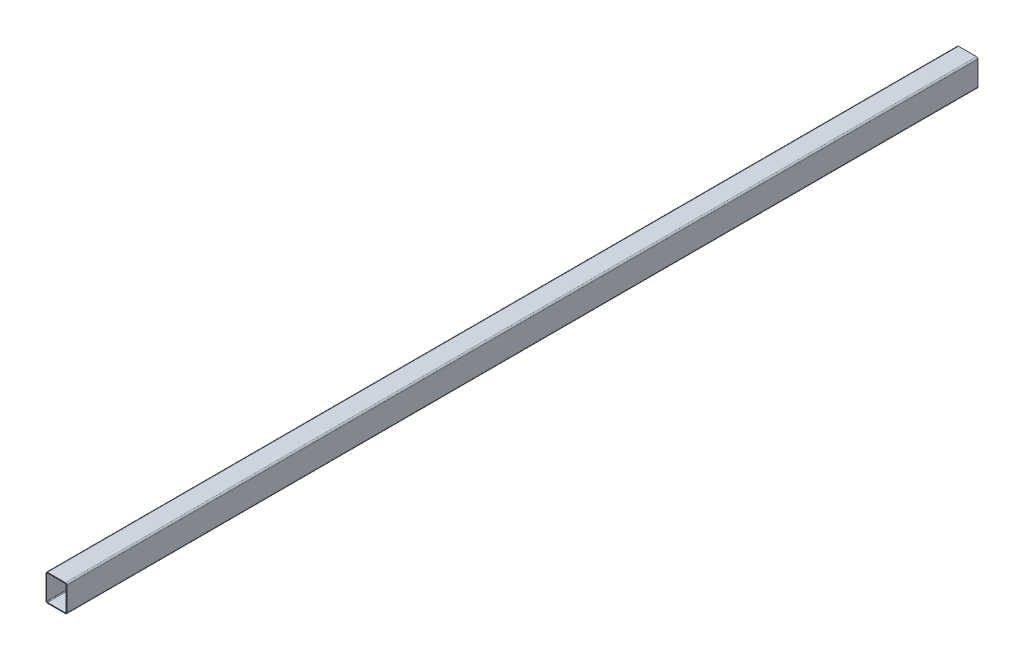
SolidWorks part; units mm, degrees
ref_plane "Front Plane" through (0, 0, 0) normal (0, 0, 1) x (1, 0, 0)
ref_plane "Top Plane" through (0, 0, 0) normal (0, 1, 0) x (1, 0, 0)
ref_plane "Right Plane" through (0, 0, 0) normal (1, 0, 0) x (0, 0, -1)
sketch "Sketch1" plane through (0, 0, 0) normal (0, 0, 1) x (1, 0, 0)
  line B0 (0.5868, 9.0765) -> (6.5868, 9.0765)
  arc B1 (7.0868, 8.5765) -> (6.5868, 9.0765) centre (6.5868, 8.5765) ccw
  line B2 (7.0868, 8.5765) -> (7.0868, 0.5765)
  arc B3 (6.5868, 0.0765) -> (7.0868, 0.5765) centre (6.5868, 0.5765) ccw
  line B4 (6.5868, 0.0765) -> (0.5868, 0.0765)
  arc B5 (0.0868, 0.5765) -> (0.5868, 0.0765) centre (0.5868, 0.5765) ccw
  line B6 (0.0868, 0.5765) -> (0.0868, 8.5765)
  arc B7 (0.5868, 9.0765) -> (0.0868, 8.5765) centre (0.5868, 8.5765) ccw
  line B8 (0.5868, 8.8265) -> (6.5868, 8.8265)
  arc B9 (6.8368, 8.5765) -> (6.5868, 8.8265) centre (6.5868, 8.5765) ccw
  line B10 (6.8368, 8.5765) -> (6.8368, 0.5765)
  arc B11 (6.5868, 0.3265) -> (6.8368, 0.5765) centre (6.5868, 0.5765) ccw
  line B12 (6.5868, 0.3265) -> (0.5868, 0.3265)
  arc B13 (0.3368, 0.5765) -> (0.5868, 0.3265) centre (0.5868, 0.5765) ccw
  line B14 (0.3368, 0.5765) -> (0.3368, 8.5765)
  arc B15 (0.5868, 8.8265) -> (0.3368, 8.5765) centre (0.5868, 8.5765) ccw
sketch_block_instance "HSS9x7x0.250-2"
sketch_block "HSS9x7x0.250"
extrude "Boss-Extrude1" add sketch "Sketch1" along normal blind 304.8
